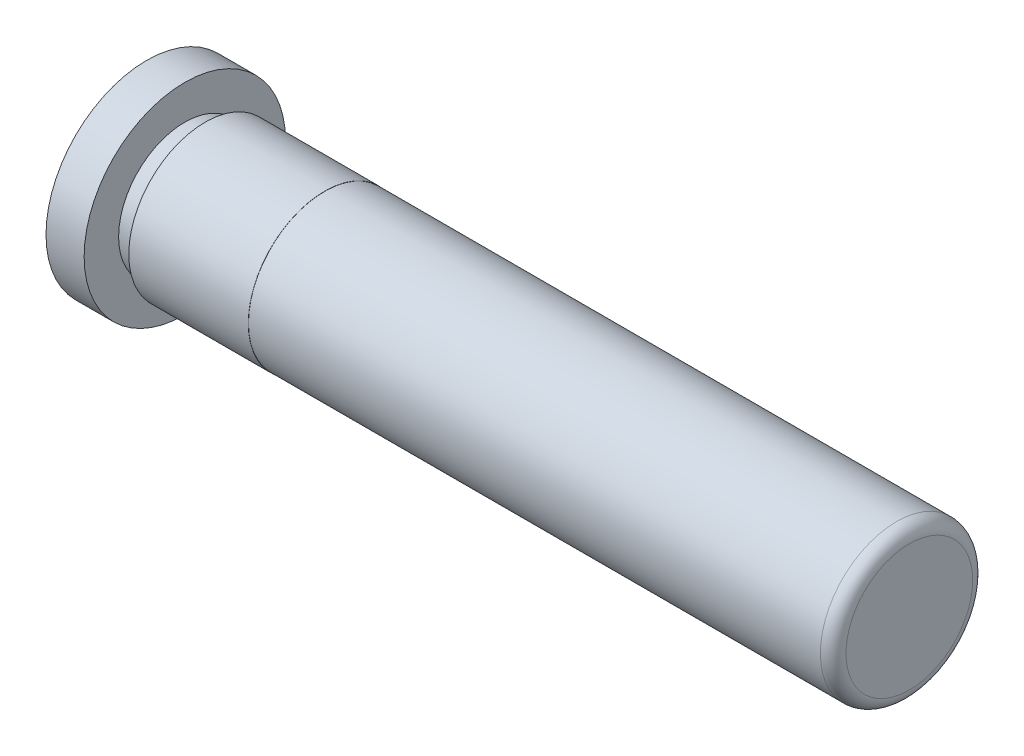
SolidWorks part; units mm, degrees
ref_plane "Plane1" through (0, 0, 0) normal (0, 0, 1) x (1, 0, 0)
ref_plane "Plane2" through (0, 0, 0) normal (0, 1, 0) x (1, 0, 0)
ref_plane "Plane3" through (0, 0, 0) normal (1, 0, 0) x (0, 0, -1)
sketch "Sketch1" plane through (0, 0, 0) normal (0, 0, 1) x (1, 0, 0)
  line L0 (2.54, 9.525) -> (17.4625, 9.525)
  line L1 (90.4875, 9.4996) -> (17.4625, 9.4996)
  line L2 (90.4875, 9.4996) -> (90.4875, -0.0127)
  line L3 (90.4875, -0.0127) -> (-4.7625, -0.0127)
  line L4 (-4.7625, -0.0127) -> (-4.7625, 12.5603)
  line L5 (-4.7625, 12.5603) -> (0, 12.5603)
  line L6 (0, 12.5603) -> (0, 8.255)
  line L7 (0, 8.255) -> (2.54, 8.255)
  line L8 (2.54, 8.255) -> (2.54, 9.525)
  line L9 (-4.7625, -0.0127) -> (73.025, -0.0127) construction
  line L10 (17.4625, 9.4996) -> (17.4625, 9.525)
revolve "Leader Pin" add sketch "Sketch1" angle 360 about L9
fillet "Fillet1" radius 1.6002 1 edges at (90.4875, -0.0127, 9.5123)
equation "\"D1@Sketch1\" = \"D3@Sketch1\""
